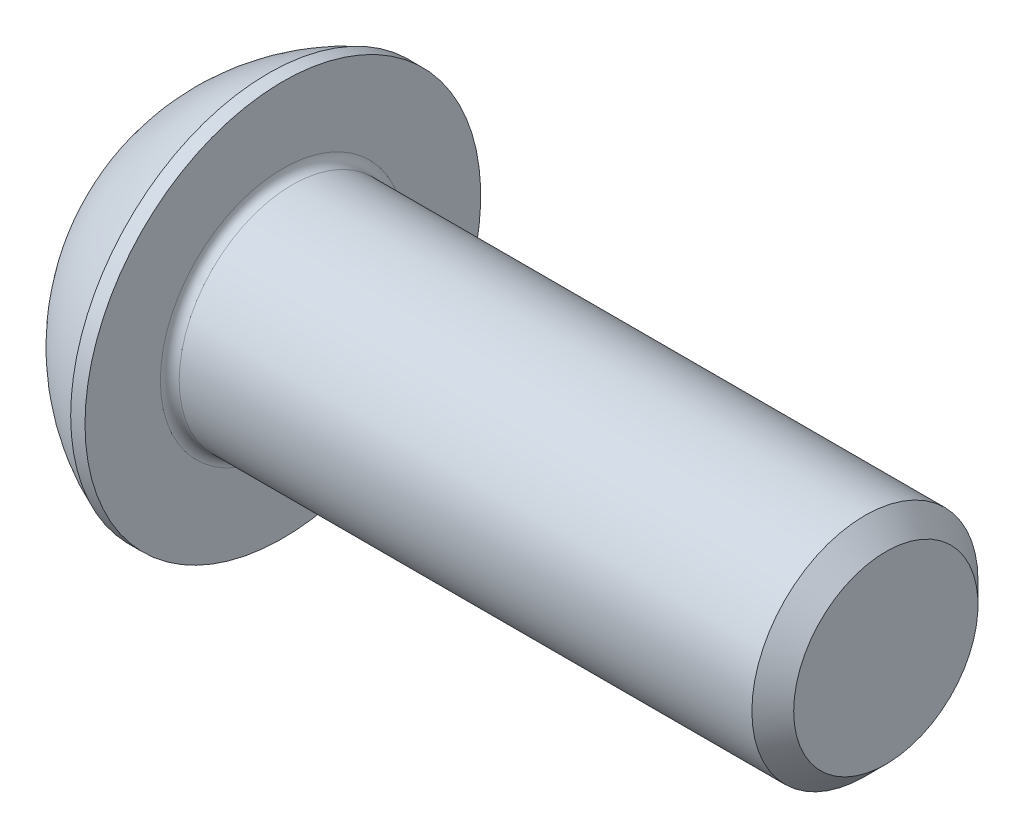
SolidWorks part; units mm, degrees
ref_plane "Plane1" through (0, 0, 0) normal (0, 0, 1) x (1, 0, 0)
ref_plane "Plane2" through (0, 0, 0) normal (0, 1, 0) x (1, 0, 0)
ref_plane "Plane3" through (0, 0, 0) normal (1, 0, 0) x (0, 0, -1)
sketch "BodySke" plane through (0, 0, 0) normal (0, 0, 1) x (1, 0, 0)
  line L0 (19.3, 0) -> (19.3, 2.4455)
  line L1 (18.7455, 3) -> (3.3, 3)
  line L2 (3.3, 3) -> (3.3, 5.25)
  line L3 (3.3, 5.25) -> (2.92, 5.25)
  line L4 (0, 0) -> (101.6, 0) construction
  line L5 (3.3, -5.25) -> (2.92, -5.25) construction
  line L6 (55.6768, -3) -> (3.3, -3) construction
  line L7 (19.3, 0) -> (0, 0)
  line L8 (0, 2.625) -> (0, -2.625) construction
  line L9 (0, 0) -> (0, 2.625)
  line L10 (19.3, 2.4455) -> (18.7455, 3)
  line L11 (19.3, -2.4455) -> (18.7455, -3) construction
  line L12 (4.3, 9.525) -> (4.3, -3) construction
  line L13 (3.3, 9.525) -> (3.3, -3) construction
  arc A1 (0, 2.625) -> (2.92, 5.25) centre (4.9997, 0) cw
revolve "BaseBody" add sketch "BodySke" angle 360 about L4
fillet "Fillet1" radius 0.25 1 edges at (3.3, 0, 3)
sketch "Sketch2" plane through (0, 0, 0) normal (0, 0, 1) x (1, 0, 0)
  line L0 (0, 2) -> (2.08, 2)
  line L1 (2.08, 2) -> (3.2347, 0)
  line L3 (3.2347, 0) -> (0, 0)
  line L4 (0, 0) -> (0, 2)
  line L5 (0, -2) -> (2.08, -2) construction
  line L6 (0, 0) -> (47.625, 0) construction
  dimension "D2" = 60
  dimension "PreBroach_depth" = 2.08
  dimension "PreBroach_dia" = 4
revolve "PreBroach" cut sketch "Sketch2" angle 360 about L6
sketch "Sketch3" plane through (0, 0, 0) normal (1, 0, 0) x (0, 0, -1)
  line L0 (-2, -1.1547) -> (-2, 1.1547)
  line L1 (-2, 1.1547) -> (0, 2.3094)
  line L2 (0, 2.3094) -> (2, 1.1547)
  line L3 (2, 1.1547) -> (2, -1.1547)
  line L4 (2, -1.1547) -> (0, -2.3094)
  line L5 (0, -2.3094) -> (-2, -1.1547)
extrude "Hex" cut sketch "Sketch3" along normal blind 2.08
sketch "ThdSchSke" plane through (0, 0, 0) normal (0, 0, 1) x (1, 0, 0)
  line L0 (5.3, -2.4455) -> (4.9117, -3)
  line L1 (5.3, -2.4455) -> (5.6883, -3)
  line L2 (5.6883, -3) -> (5.6883, -3.75)
  line L3 (-3.175, 0) -> (5.1513, 0) construction
  line L5 (5.6883, -3.75) -> (4.9117, -3.75)
  line L6 (4.9117, -3.75) -> (4.9117, -3)
revolve "ThreadSchematic" [suppressed] cut sketch "ThdSchSke" angle 360 about L3
pattern_linear "ThdSchPat" [suppressed]
equation "\"D1@BodySke\" = \"Head_dia@BodySke\" * .5"
equation "\"Thread_minor@ThreadCosmetic\" = \"Minor_dia@BodySke\""
equation "\"D1@Sketch3\" = \"Hex_size@Sketch3\" / 2"
equation "\"D2@Sketch3\" = \"D1@Sketch3\""
equation "\"D3@Sketch3\" = \"Hex_size@Sketch3\""
equation "\"Thread_length@ThreadCosmetic\" = ((sgn( (\"Length@BodySke\" - \"Advance@BodySke\" * 2.0) - \"Thread_nom@BodySke\" )-1)*( (\"Length@BodySke\" - \"Advance@BodySke\" * 2.0) - \"Thread_nom@BodySke\" ))/-2+ \"Thread_no"
equation "\"Thread_minor@ThdSchSke\" = \"Minor_dia@BodySke\""
equation "\"Diameter@ThdSchSke\" = \"Diameter@BodySke\""
equation "\"Overcut@ThdSchSke\" = \"Diameter@BodySke\" * 1.25"
equation "\"Start@ThdSchSke\" = \"Head_ht@BodySke\" + \"Length@BodySke\" - \"Thread_length@ThreadCosmetic\"  '---Non-countersunk---"
equation "\"Num_threads@ThdSchPat\" = int( \"Thread_length@ThreadCosmetic\" / \"Advance@BodySke\" + 0.999 )  + 1"
equation "\"Advance@ThdSchPat\" = \"Thread_length@ThreadCosmetic\" /  (\"Num_threads@ThdSchPat\" - 1) 'relax it"
equation "\"Num_threads@ThdSchPat\" = \"Num_threads@ThdSchPat\" - sgn( \"Num_threads@ThdSchPat\" - 1) '---chamfered tips only---"
